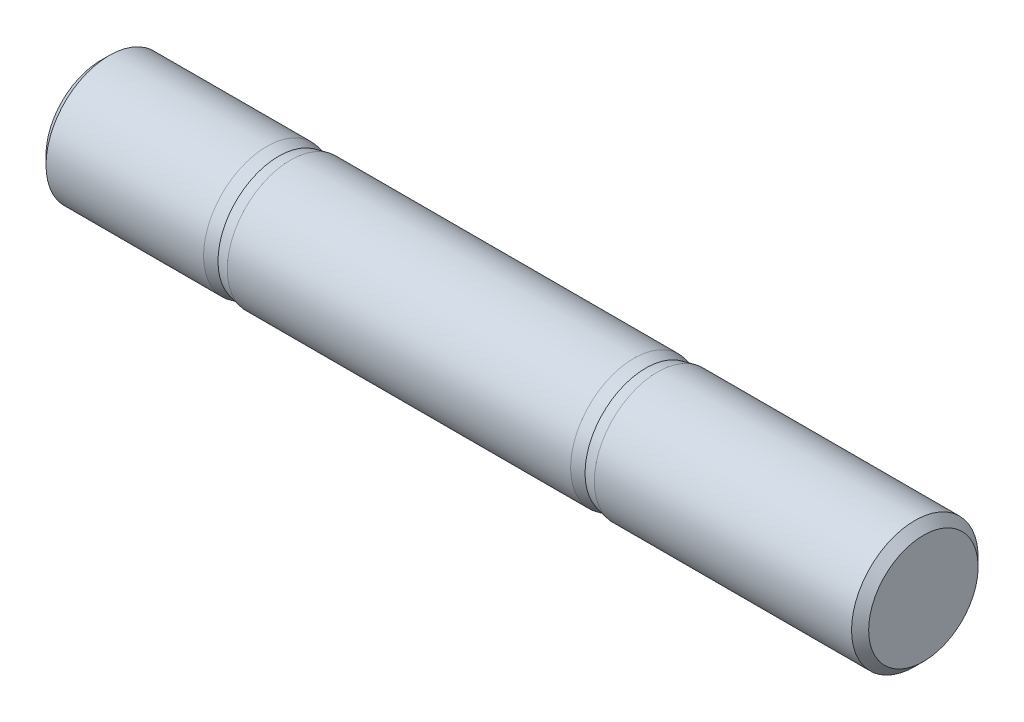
SolidWorks part; units mm, degrees
ref_plane "Front" through (0, 0, 0) normal (0, 0, 1) x (1, 0, 0)
ref_plane "Top" through (0, 0, 0) normal (0, 1, 0) x (1, 0, 0)
ref_plane "Right" through (0, 0, 0) normal (1, 0, 0) x (0, 0, -1)
sketch "Sketch1" plane through (0, 0, 0) normal (0, 0, 1) x (1, 0, 0)
  line L0 (-1.3108, 0) -> (30.3862, 0) construction
  line L1 (0, 0) -> (0, 10)
  line L2 (0, 10) -> (26.25, 10)
  line L3 (26.25, 10) -> (30, 9.188)
  line L4 (30, 9.188) -> (84.25, 9.188)
  line L5 (84.25, 9.188) -> (88, 10)
  line L6 (88, 10) -> (130, 10)
  line L7 (130, 10) -> (130, 0)
  line L8 (130, 0) -> (0, 0)
  dimension "X" = 3.75
  dimension "D2" = 3.75
  dimension "bm" = 30
  dimension "b" = 42
  dimension "l" = 100
  dimension "d" = 20
  dimension "ds" = 18.376
revolve "BaseHead" add sketch "Sketch1" angle 360 about L0
chamfer "HeadChamfer" distance 1.353 angle 45 2 edges at (0, 0, 10) (130, 0, 10)
sketch "Sketch2" plane through (0, 0, 0) normal (0, 0, 1) x (1, 0, 0)
  line L0 (-1.3108, 0) -> (31.2107, 0) construction
  line L2 (26.25, 9.188) -> (30, 10)
  line L3 (30, 10) -> (84.25, 10)
  line L4 (84.25, 10) -> (88, 9.188)
  line L7 (26.25, 10) -> (26.25, -10) construction
  line L9 (26.25, 9.188) -> (88, 9.188)
  line L10 (88, 10) -> (88, -10) construction
  dimension "D1" = 3.75
  dimension "D2" = 20
revolve "BaseBody" add sketch "Sketch2" angle 360 about L0
sketch "Sketch3" plane through (0, 0, 0) normal (0, 0, 1) x (1, 0, 0)
  line L0 (128.647, 8.8283) -> (129.3235, 10)
  line L1 (129.3235, 10) -> (129.3235, 10.5)
  line L2 (129.3235, 10.5) -> (127.9705, 10.5)
  line L3 (127.9705, 10.5) -> (127.9705, 10)
  line L4 (127.9705, 10) -> (128.647, 8.8283)
  line L5 (0, 0) -> (54.5942, 0) construction
  line L6 (128.647, 10) -> (128.647, -10) construction
  dimension "D1" = 60
  dimension "D2" = 60
  dimension "D3" = 0.5
  dimension "D4" = 1.353
  dimension "D5" = 20
revolve "Cut-Revolve10" [suppressed] cut sketch "Sketch3" angle 360 about L5
pattern_linear "LPattern10" [suppressed] count 26 spacing 1.6236 along (1, 0, 0)
sketch "Sketch4" plane through (0, 0, 0) normal (0, 0, 1) x (1, 0, 0)
  line L0 (1.353, 8.8283) -> (2.0295, 10)
  line L1 (2.0295, 10) -> (2.0295, 10.5)
  line L2 (2.0295, 10.5) -> (0.6765, 10.5)
  line L3 (0.6765, 10.5) -> (0.6765, 10)
  line L4 (0.6765, 10) -> (1.353, 8.8283)
  line L5 (0, 0) -> (16.1581, 0) construction
  line L6 (0, 8.647) -> (0, -8.647) construction
  line L7 (1.353, 10) -> (1.353, -10) construction
  dimension "D1" = 60
  dimension "D2" = 60
  dimension "D3" = 0.5
  dimension "D4" = 1.353
  dimension "D5" = 20
revolve "Cut-Revolve11" [suppressed] cut sketch "Sketch4" angle 360 about L5
pattern_linear "LPattern11" [suppressed] count 16 spacing 1.6236 along (1, 0, 0)
equation "\"D2@Sketch1\" = \"X@Sketch1\""
equation "\"D2@ThreadCosmetic2\" = \"D2@ThreadCosmetic1\""
equation "\"D1@ThreadCosmetic1\" = \"bm@Sketch1\"-\"X@Sketch1\""
equation "\"b@ThreadCosmetic2\" = \"b@Sketch1\""
equation "\"D1@Sketch2\" = \"X@Sketch1\""
equation "\"D2@Sketch2\" = \"d@Sketch1\""
equation "\"D1@HeadChamfer\" =  ( \"d@Sketch1\" - \"D2@ThreadCosmetic1\" )  / 2"
equation "\"D5@Sketch3\" = \"d@Sketch1\""
equation "\"D4@Sketch3\" = (  \"d@Sketch1\" - \"D2@ThreadCosmetic2\" )  / 2"
equation "\"D3@LPattern10\" = \"D4@Sketch3\" * 1.2"
equation "\"D1@LPattern10\" = \"b@ThreadCosmetic2\" / \"D3@LPattern10\""
equation "\"D5@Sketch4\" = \"d@Sketch1\""
equation "\"D4@Sketch4\" = (  \"d@Sketch1\" - \"D2@ThreadCosmetic1\" )  / 2"
equation "\"D3@LPattern11\" = \"D4@Sketch4\" * 1.2"
equation "\"D1@LPattern11\" = \"D1@ThreadCosmetic1\" / \"D3@LPattern11\""
